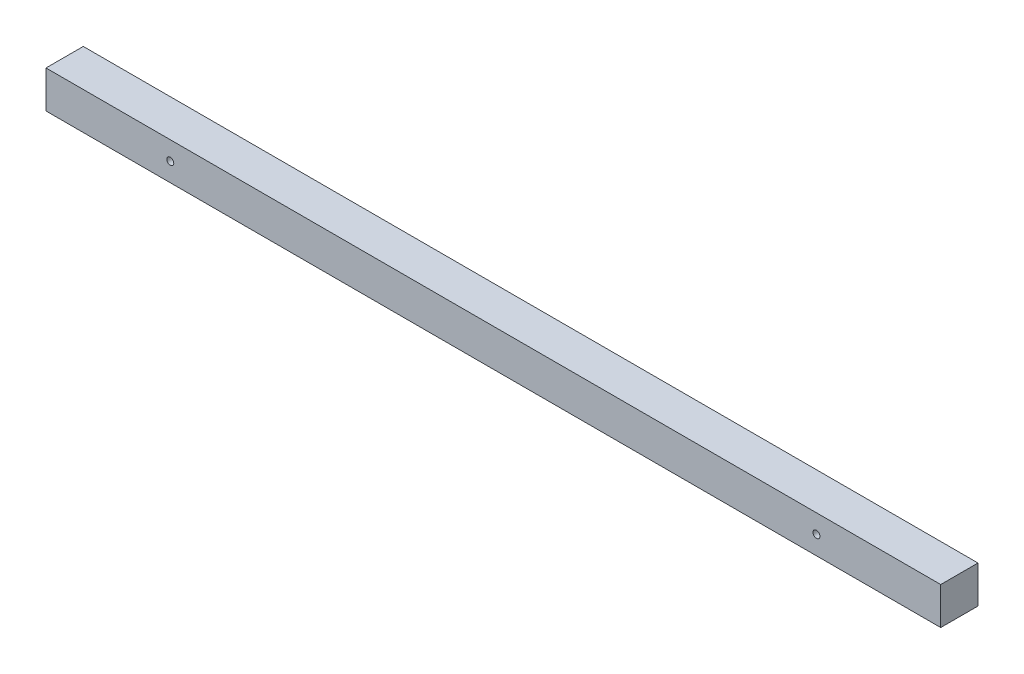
SolidWorks part; units mm, degrees
ref_plane "Front Plane" through (0, 0, 0) normal (0, 0, 1) x (1, 0, 0)
ref_plane "Top Plane" through (0, 0, 0) normal (0, 1, 0) x (1, 0, 0)
ref_plane "Right Plane" through (0, 0, 0) normal (1, 0, 0) x (0, 0, -1)
sketch "Sketch1" plane through (0, 0, 0) normal (1, 0, 0) x (0, 0, -1)
  line L0 (-19.05, 0) -> (0, 0) construction
  line L1 (-19.05, 19.05) -> (19.05, 19.05)
  line L2 (-19.05, 19.05) -> (-19.05, -19.05)
  line L3 (-19.05, -19.05) -> (19.05, -19.05)
  line L4 (19.05, 19.05) -> (19.05, -19.05)
  line L5 (0, 0) -> (0, -19.05) construction
  dimension "D1" = 38.1
extrude "Boss-Extrude1" add sketch "Sketch1" along normal mid plane 914.4
sketch "Sketch2" plane through (0, 0, 19.05) normal (0, 0, 1) x (1, 0, 0)
  line L0 (-330.2, 0) -> (330.2, 0) construction
  circle A0 centre (-330.2, 0) radius 3.5687
  circle A1 centre (330.2, 0) radius 3.5687
  dimension "D1" = 7.1374
  dimension "D2" = 660.4
extrude "Cut-Extrude1" cut sketch "Sketch2" against normal through all
sketch "Sketch3" plane through (0, 19.05, 0) normal (0, 1, 0) x (1, 0, 0)
  line L0 (238.76, 0) -> (-238.76, 0) construction
  line L1 (264.16, -226.6156) -> (264.16, 179.7844) construction
  circle A0 centre (238.76, 0) radius 2.3813
  circle A1 centre (0, 0) radius 2.3813
  circle A2 centre (-238.76, 0) radius 2.3813
  dimension "D2" = 4.7625
  dimension "D1" = 25.4
